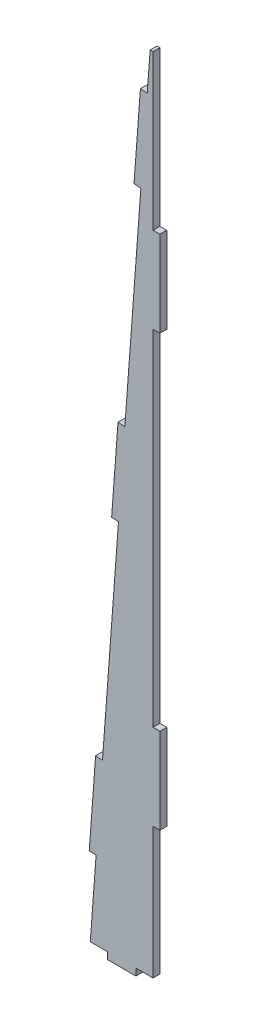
SolidWorks part; units mm, degrees
ref_plane "Front Plane" through (0, 0, 0) normal (0, 0, 1) x (1, 0, 0)
ref_plane "Top Plane" through (0, 0, 0) normal (0, 1, 0) x (1, 0, 0)
ref_plane "Right Plane" through (0, 0, 0) normal (1, 0, 0) x (0, 0, -1)
sketch "Sketch1" plane through (0, 0, 0) normal (0, 0, 1) x (1, 0, 0)
  line L0 (-1.524, 145.5133) -> (0, 145.5133)
  line L1 (0, 145.5133) -> (0, 126.4633)
  line L2 (0, 126.4633) -> (-1.524, 126.4633)
  line L3 (-1.524, 126.4633) -> (-1.524, 49.8887)
  line L4 (-1.524, 49.8887) -> (0, 49.8887)
  line L5 (0, 49.8887) -> (0, 30.8387)
  line L6 (0, 30.8387) -> (-1.524, 30.8387)
  line L7 (-1.524, 30.8387) -> (-1.524, 1.6598)
  line L8 (-1.524, 1.6598) -> (-5.3198, 1.6598)
  line L9 (-15.4657, 1.6598) -> (-14.1763, 18.9406)
  line L10 (-1.524, 179.8766) -> (-1.524, 145.5133)
  line L11 (-11.6698, 1.6598) -> (-15.4657, 1.6598)
  line L12 (-11.6698, 1.6598) -> (-11.6698, 0.1358)
  line L13 (-5.3198, 1.6598) -> (-5.3198, 0.1358)
  line L14 (-5.7505, 152.3524) -> (-4.3331, 171.3496)
  line L15 (-11.6698, 0.1358) -> (-5.3198, 0.1358)
  line L16 (-12.7589, 37.9377) -> (-14.2787, 38.0511)
  line L17 (-14.1763, 18.9406) -> (-15.6961, 19.0539)
  line L18 (-2.1687, 179.8766) -> (-1.524, 179.8766)
  line L19 (-14.2787, 38.0511) -> (-15.6961, 19.0539)
  line L20 (-2.8133, 171.2362) -> (-2.1687, 179.8766)
  line L21 (-7.7861, 104.587) -> (-4.2307, 152.239)
  line L22 (-2.8133, 171.2362) -> (-4.3331, 171.3496)
  line L23 (-4.2307, 152.239) -> (-5.7505, 152.3524)
  line L24 (-7.7861, 104.587) -> (-9.3059, 104.7003)
  line L25 (-9.2035, 85.5898) -> (-10.7233, 85.7032)
  line L26 (-12.7589, 37.9377) -> (-9.2035, 85.5898)
  line L27 (-9.3059, 104.7003) -> (-10.7233, 85.7032)
extrude "Boss-Extrude1" add sketch "Sketch1" along normal blind 1.524
